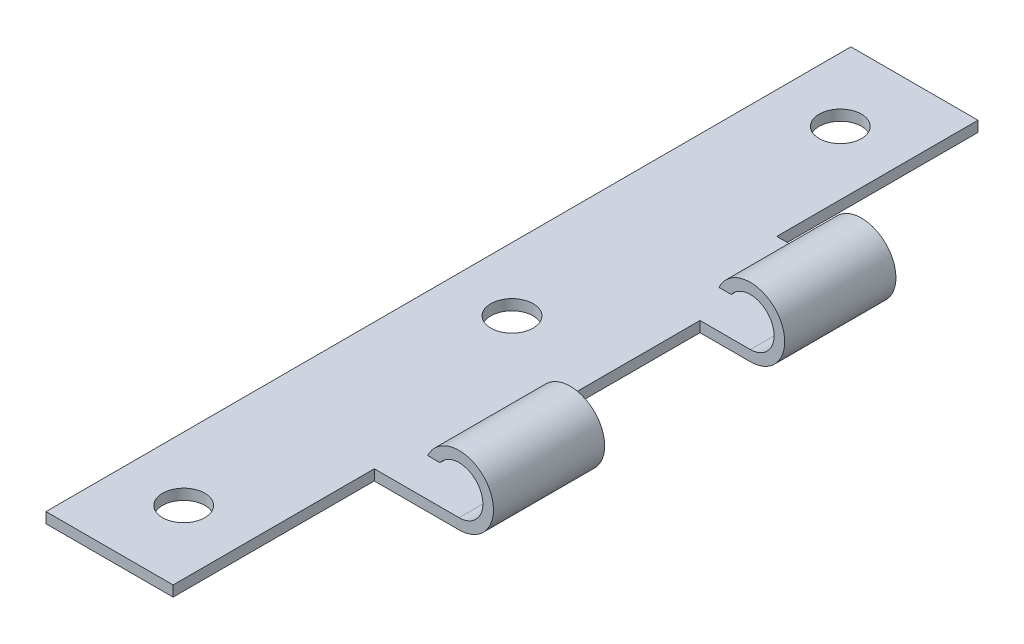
SolidWorks part; units mm, degrees
ref_plane "正面" through (0, 0, 0) normal (0, 0, 1) x (1, 0, 0)
ref_plane "平面" through (0, 0, 0) normal (0, 1, 0) x (1, 0, 0)
ref_plane "右側面" through (0, 0, 0) normal (1, 0, 0) x (0, 0, -1)
sketch "ｽｹｯﾁ1" plane through (0, 0, 0) normal (0, 0, 1) x (1, 0, 0)
  circle A0 centre (0, 0) radius 3.25
  dimension "D1" = 3.25
extrude "ﾎﾞｽ - 押し出し1" add sketch "ｽｹｯﾁ1" along normal mid plane 76
sketch "ｽｹｯﾁ2" plane through (0, 0, 0) normal (0, 0, 1) x (1, 0, 0)
  line L1 (-20, -2.25) -> (0, -2.25)
  line L2 (-20, -2.25) -> (-20, -3.25)
  line L3 (-20, -3.25) -> (0, -3.25)
  line L4 (0, -2.25) -> (0, -3.25)
  circle A0 centre (0, 0) radius 3.25 construction
  dimension "D1" = 20
  dimension "D2" = 1
extrude "ﾎﾞｽ - 押し出し2" add sketch "ｽｹｯﾁ2" along normal up to surface and the other way up to surface
sketch "ｽｹｯﾁ3" plane through (0, 0, 38) normal (0, 0, 1) x (1, 0, 0)
  circle A0 centre (0, 0) radius 2.25
  arc A1 (0, -3.25) -> (-2.3452, -2.25) centre (0, 0) ccw construction
  dimension "D1" = 1
extrude "ｶｯﾄ - 押し出し1" cut sketch "ｽｹｯﾁ3" against normal up to next
sketch "ｽｹｯﾁ4" plane through (0, 0, 38) normal (0, 0, 1) x (1, 0, 0)
  line L0 (-3.25, -2.25) -> (0, -2.25)
  line L1 (0, -2.25) -> (0, 1.35)
  line L2 (-3.25, -2.25) -> (-3.25, 1.35)
  line L3 (-2.3452, -2.25) -> (-20, -2.25) construction
  line L4 (-3.25, 1.35) -> (0, 1.35)
  arc A0 (0, -3.25) -> (-2.3452, -2.25) centre (0, 0) ccw construction
  point P2 (-0.1495, 1.0527)
  dimension "D1" = 3.6
extrude "ｶｯﾄ - 押し出し2" cut sketch "ｽｹｯﾁ4" against normal up to next
sketch "ｽｹｯﾁ5" plane through (0, -3.25, 0) normal (0, -1, 0) x (1, 0, 0)
  line L0 (0, 38) -> (-20, 38) construction
  line L1 (-8, -38) -> (3.25, -38)
  line L2 (-8, -38) -> (-8, -19)
  line L3 (-8, -19) -> (3.25, -19)
  line L4 (3.25, -38) -> (3.25, -19)
  line L5 (-4.75, -8.5) -> (3.25, -8.5)
  line L6 (-4.75, -8.5) -> (-4.75, 8.5)
  line L7 (-4.75, 8.5) -> (3.25, 8.5)
  line L8 (3.25, -8.5) -> (3.25, 8.5)
  line L9 (-8, 19) -> (3.25, 19)
  line L10 (-8, 19) -> (-8, 38)
  line L11 (-8, 38) -> (3.25, 38)
  line L12 (3.25, 19) -> (3.25, 38)
  line L13 (-20, -38) -> (0, -38) construction
  line L14 (3.25, -38) -> (3.25, 38) construction
  line L15 (0, 0) -> (-4.75, 0) construction
  line L16 (-20, 38) -> (-20, -38) construction
  dimension "D1" = 17
  dimension "D2" = 19
  dimension "D3" = 12
  dimension "D4" = 15.25
extrude "ｶｯﾄ - 押し出し3" cut sketch "ｽｹｯﾁ5" against normal through all
hole_wizard "Ø4.0 (4) 直径の穴1" positions "ｽｹｯﾁ7" profile "ｽｹｯﾁ6" hole size "Ø4.0" standard "JIS"
sketch "ｽｹｯﾁ7" plane through (0, -2.25, 0) normal (0, 1, 0) x (-1, 0, 0)
  line L0 (20, 38) -> (20, -38) construction
  point P0 (14, -31)
  point P2 (14, 0)
  point P4 (14, 31)
  dimension "D1" = 31
  dimension "D2" = 31
  dimension "D3" = 6
sketch "ｽｹｯﾁ6" plane through (-14, -2.25, -31) normal (1, 0, 0) x (0, 0, 1)
  line L0 (0, 0) -> (0, 1)
  line L1 (0, 1) -> (2, 1)
  line L2 (2, 1) -> (2, 0)
  line L5 (2, 0) -> (0, 0)
  line L11 (0, -6.35) -> (0, 107.95) construction
  dimension "通し穴の直径" = 4
  dimension "通し穴の深さ" = 1
